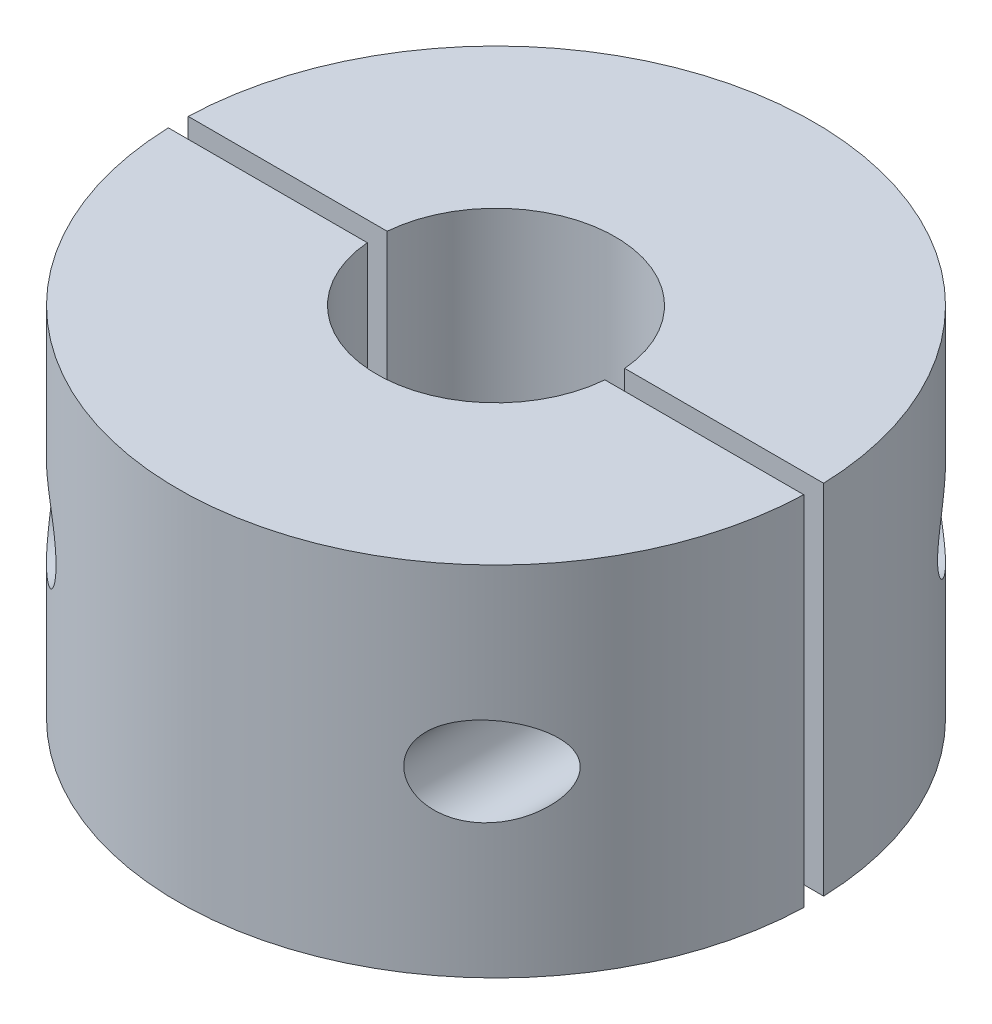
SolidWorks part; units mm, degrees
ref_plane "前视基准面" through (0, 0, 0) normal (0, 0, 1) x (1, 0, 0)
ref_plane "上视基准面" through (0, 0, 0) normal (0, 1, 0) x (1, 0, 0)
ref_plane "右视基准面" through (0, 0, 0) normal (1, 0, 0) x (0, 0, -1)
other "Configuration Table"
sketch "草图1" plane through (0, 0, 0) normal (0, 1, 0) x (1, 0, 0)
  circle A0 centre (0, 0) radius 8
  dimension "D1" = 16
extrude "凸台-拉伸1" add sketch "草图1" along normal blind 9
sketch "草图3" plane through (0, 9, 0) normal (0, 1, 0) x (1, 0, 0)
  circle A1 centre (0, 0) radius 3
  dimension "D1" = 6
extrude "切除-拉伸2" cut sketch "草图3" against normal through all
sketch "草图5" plane through (0, 9, 0) normal (0, 1, 0) x (1, 0, 0)
  line L1 (-10, -0.25) -> (10, -0.25)
  line L2 (-10, -0.25) -> (-10, 0.25)
  line L3 (-10, 0.25) -> (10, 0.25)
  line L4 (10, -0.25) -> (10, 0.25)
  line L5 (-10, -0.25) -> (10, 0.25) construction
  line L6 (-10, 0.25) -> (10, -0.25) construction
  point P0 (0, 0)
  dimension "D1" = 0.5
  dimension "D2" = 20
extrude "切除-拉伸4" cut sketch "草图5" against normal through all
sketch "草图6" plane through (0, 0, 0) normal (0, 0, 1) x (1, 0, 0)
  line L0 (7.9961, 9) -> (7.9961, 0) construction
  line L1 (7.9961, 9) -> (-7.9961, 9) construction
  line L2 (0, -4.95) -> (0, 4.95) construction
  circle A0 centre (5.4961, 4.5) radius 1.1202
  circle A1 centre (-5.4961, 4.5) radius 1.1202
  dimension "D1" = 2.5
  dimension "D2" = 4.5
extrude "切除-拉伸5" cut sketch "草图6" against normal through all and the other way through all
